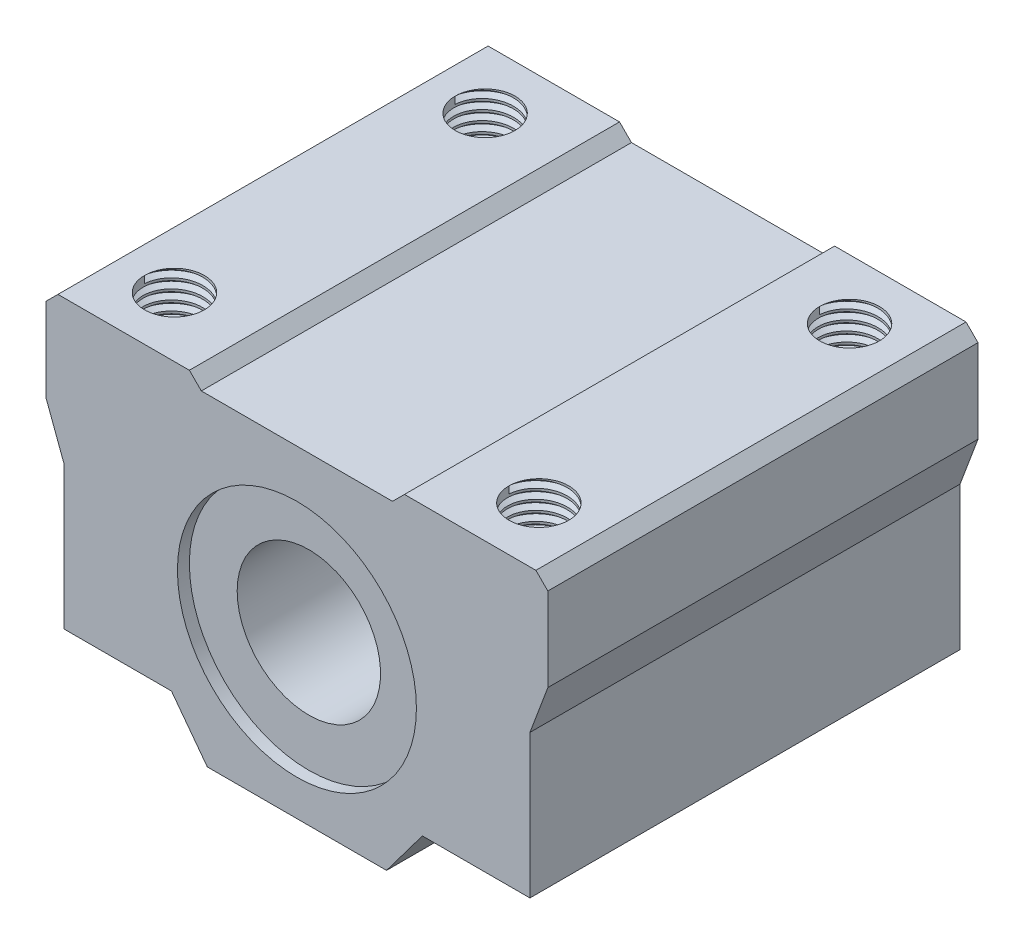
SolidWorks part; units mm, degrees
ref_plane "Alzado" through (0, 0, 0) normal (0, 0, 1) x (1, 0, 0)
ref_plane "Planta" through (0, 0, 0) normal (0, 1, 0) x (1, 0, 0)
ref_plane "Vista lateral" through (0, 0, 0) normal (1, 0, 0) x (0, 0, -1)
imported_body "Sólido importado3"
draft "Ángulo de salida1" type of draft neutral plane draft angle 69.444 faces to draft 1 parameters "D1"=69.444
draft "Ángulo de salida2" type of draft neutral plane draft angle 69.444 faces to draft 1 parameters "D1"=69.444
draft "Ángulo de salida3" type of draft neutral plane draft angle 45 faces to draft 2 parameters "D1"=45
draft "Ángulo de salida4" type of draft neutral plane draft angle 36.87 faces to draft 2 parameters "D1"=36.87
ref_plane "Plano1" through (0, 0, 0) normal (0, -1, 0) x (1, 0, 0)
sketch "Croquis1" plane through (0, 0, 0) normal (0, -1, 0) x (1, 0, 0)
  line L0 (10, 18) -> (0, 18)
  line L1 (0, 18) -> (0, -18)
  line L2 (0, -18) -> (10, -18)
  line L3 (10, -18) -> (10, -17)
  line L4 (10, -17) -> (6, -17)
  line L5 (6, -17) -> (6, 17)
  line L6 (6, 17) -> (10, 17)
  line L7 (10, 17) -> (10, 18)
  line L8 (0, 18) -> (0, -18) construction
revolve "Cortar-Revolución1" cut sketch "Croquis1" angle 360 about L8
